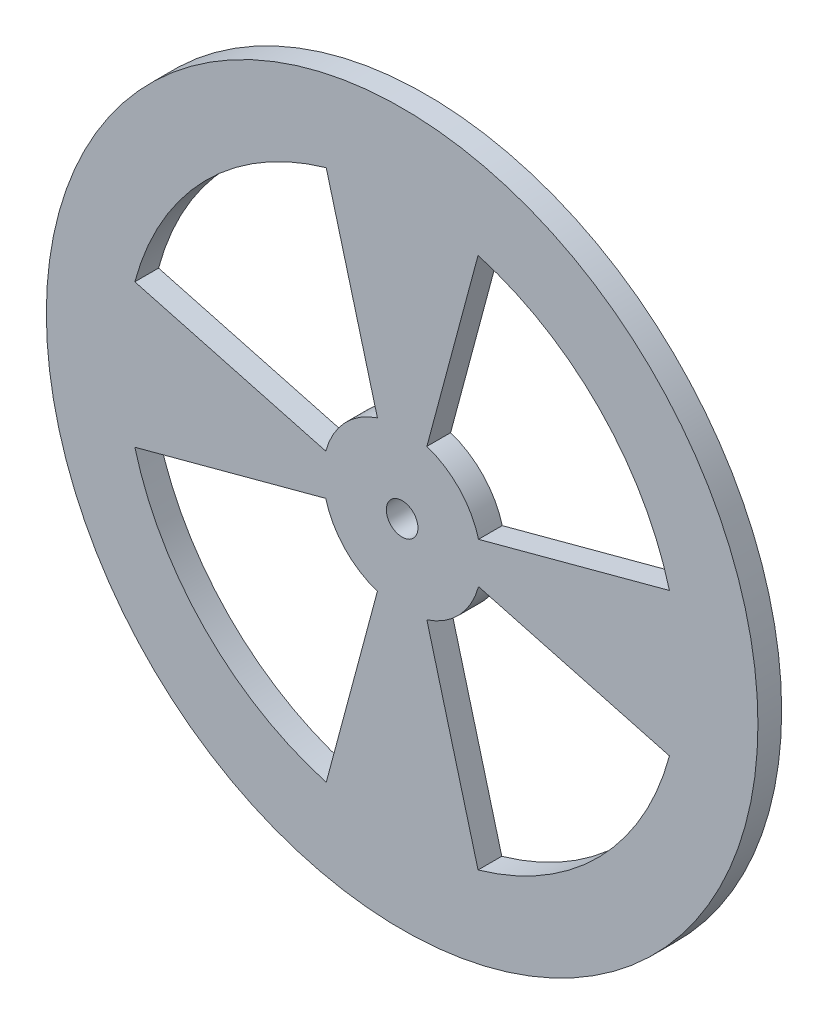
SolidWorks part; units mm, degrees
ref_plane "Plan de face" through (0, 0, 0) normal (0, 0, 1) x (1, 0, 0)
ref_plane "Plan de dessus" through (0, 0, 0) normal (0, 1, 0) x (1, 0, 0)
ref_plane "Plan de droite" through (0, 0, 0) normal (1, 0, 0) x (0, 0, -1)
sketch "Esquisse1" plane through (0, 0, 0) normal (0, 0, 1) x (1, 0, 0)
  line L0 (0, 0) -> (-29.4323, 0) construction
  line L1 (0, 0) -> (0, 24.3094) construction
  line L2 (-9.6011, 33.6574) -> (-3.1277, 9.4983)
  line L3 (-9.6593, 2.5882) -> (-33.8074, 9.0587)
  line L4 (-9.6011, -33.6574) -> (-3.1277, -9.4983)
  line L5 (-9.6593, -2.5882) -> (-33.8074, -9.0587)
  line L6 (9.6011, 33.6574) -> (3.1277, 9.4983)
  line L7 (9.6593, 2.5882) -> (33.8074, 9.0587)
  line L8 (9.6593, -2.5882) -> (33.8074, -9.0587)
  line L9 (9.6011, -33.6574) -> (3.1277, -9.4983)
  circle A0 centre (0, 0) radius 45
  circle A1 centre (0, 0) radius 2
  circle A2 centre (0, 0) radius 35
  circle A3 centre (0, 0) radius 10
  dimension "D1" = 90
  dimension "D2" = 4
  dimension "D3" = 10
  dimension "D6" = 20
  dimension "D4" = 15
  dimension "D5" = 15
extrude "Boss.-Extru.1" add sketch "Esquisse1" along normal blind 3 contours A3 L6 A2 L2 | A3 A1 | A3 L8 A2 L7 | A3 L4 A2 L9 | A0 A2 | A3 L3 A2 L5
